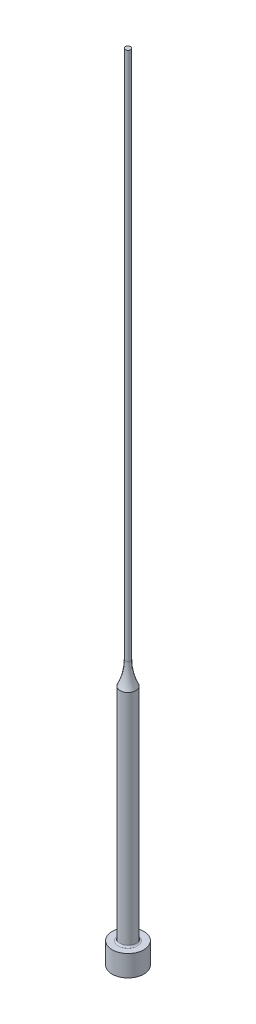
SolidWorks part; units mm, degrees
ref_plane "Front Plane" through (0, 0, 0) normal (0, 0, 1) x (1, 0, 0)
ref_plane "Top Plane" through (0, 0, 0) normal (0, 1, 0) x (1, 0, 0)
ref_plane "Right Plane" through (0, 0, 0) normal (1, 0, 0) x (0, 0, -1)
sketch "Sketch1" plane through (0, 0, 0) normal (0, 0, 1) x (1, 0, 0)
  line L0 (0, 0) -> (3, 0)
  line L1 (55, 0) -> (-55, 0) construction
  line L2 (3, 0) -> (3, 4)
  line L3 (3, 4) -> (1.8, 4)
  line L4 (1.5, 4.3) -> (1.5, 45.6411)
  line L6 (0.5, 50) -> (0.5, 150)
  line L7 (0.5, 150) -> (0, 150)
  line L8 (0, 150) -> (0, 0)
  arc A0 (0.5, 50) -> (1.5, 45.6411) centre (10.5, 50) ccw
  arc A1 (1.8, 4) -> (1.5, 4.3) centre (1.8, 4.3) cw
  dimension "D7" = 50
  dimension "D8" = 0.3
  dimension "D5" = 10
  dimension "D1" = 0.5
  dimension "D2" = 1.5
  dimension "D3" = 3
  dimension "D4" = 4
  dimension "D6" = 150
revolve "Revolve1" add sketch "Sketch1" angle 360 about L8
